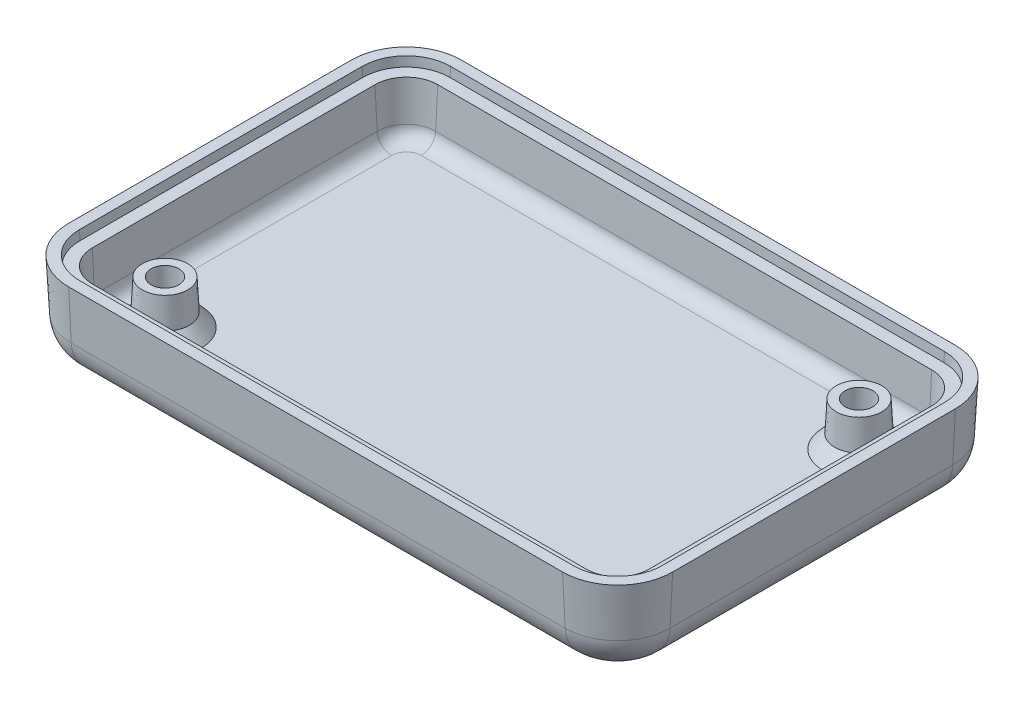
SolidWorks part; units mm, degrees
ref_plane "Front Plane" through (0, 0, 0) normal (0, 0, 1) x (1, 0, 0)
ref_plane "Top Plane" through (0, 0, 0) normal (0, 1, 0) x (1, 0, 0)
ref_plane "Right Plane" through (0, 0, 0) normal (1, 0, 0) x (0, 0, -1)
sketch "Sketch1" plane through (0, 0, 0) normal (0, 1, 0) x (1, 0, 0)
  line L0 (-25.9842, 20.6629) -> (25.9842, 20.6629)
  line L1 (31.7754, -14.8717) -> (31.7754, 14.8717)
  line L2 (-25.9842, -20.6629) -> (25.9842, -20.6629)
  line L3 (-31.7754, -14.8717) -> (-31.7754, 14.8717)
  line L4 (-31.7754, 0) -> (31.7754, 0) construction
  line L5 (0, -20.6629) -> (0, 20.6629) construction
  line L6 (25.9842, 14.8717) -> (-25.9842, -14.8717) construction
  arc A0 (31.7754, 14.8717) -> (25.9842, 20.6629) centre (25.9842, 14.8717) ccw
  arc A1 (25.9842, -20.6629) -> (31.7754, -14.8717) centre (25.9842, -14.8717) ccw
  arc A2 (-31.7754, -14.8717) -> (-25.9842, -20.6629) centre (-25.9842, -14.8717) ccw
  arc A3 (-25.9842, 20.6629) -> (-31.7754, 14.8717) centre (-25.9842, 14.8717) ccw
  dimension "D1" = 5.7912
  dimension "D2" = 63.5508
  dimension "D3" = 41.3258
extrude "Extrude1" add sketch "Sketch1" against normal blind 9.017 draft 3
fillet "Fillet1" radius 3.9624 8 edges at (-29.745, -9.017, 18.6325) (-31.3028, -9.017, 0) (-29.745, -9.017, -18.6325) (0, -9.017, -20.1903) (29.745, -9.017, -18.6325) (31.3028, -9.017, 0) (29.745, -9.017, 18.6325) (0, -9.017, 20.1903)
shell "Shell1" thickness 2.4384
sketch "Sketch2" plane through (0, 0, 0) normal (0, 1, 0) x (-1, 0, 0)
  line L9 (30.6324, -14.8717) -> (30.6324, 14.8717)
  line L10 (25.9842, 19.5199) -> (-25.9842, 19.5199)
  line L11 (-30.6324, 14.8717) -> (-30.6324, -14.8717)
  line L12 (-25.9842, -19.5199) -> (25.9842, -19.5199)
  line L13 (30.6324, -14.8717) -> (30.6324, 14.8717)
  line L14 (25.9842, 19.5199) -> (-25.9842, 19.5199)
  line L15 (-30.6324, 14.8717) -> (-30.6324, -14.8717)
  line L16 (-25.9842, -19.5199) -> (25.9842, -19.5199)
  arc A8 (25.9842, -19.5199) -> (30.6324, -14.8717) centre (25.9842, -14.8717) ccw
  arc A9 (30.6324, 14.8717) -> (25.9842, 19.5199) centre (25.9842, 14.8717) ccw
  arc A10 (-25.9842, 19.5199) -> (-30.6324, 14.8717) centre (-25.9842, 14.8717) ccw
  arc A11 (-30.6324, -14.8717) -> (-25.9842, -19.5199) centre (-25.9842, -14.8717) ccw
  arc A12 (25.9842, -19.5199) -> (30.6324, -14.8717) centre (25.9842, -14.8717) ccw
  arc A13 (30.6324, 14.8717) -> (25.9842, 19.5199) centre (25.9842, 14.8717) ccw
  arc A14 (-25.9842, 19.5199) -> (-30.6324, 14.8717) centre (-25.9842, 14.8717) ccw
  arc A15 (-30.6324, -14.8717) -> (-25.9842, -19.5199) centre (-25.9842, -14.8717) ccw
  dimension "D2" = 39.0398
  dimension "D3" = 61.2648
  dimension "D1" = 1.143
extrude "Cut-Extrude1" cut sketch "Sketch2" against normal blind 0.9906 draft 3
sketch "Sketch3-REF. FOR PLANES" plane through (0, -6.5786, 0) normal (0, 1, 0) x (-1, 0, 0)
  line L0 (0, 0) -> (-50000, 0) construction
  line L1 (0, 0) -> (0, 50000) construction
  line L2 (23.8125, 12.7) -> (0, 0) construction
  line L3 (0, 0) -> (5.8426, -10.9548) construction
  point P1 (23.8125, 12.7)
  point P9 (-23.8125, -12.7)
  dimension "D1" = 28.072
  dimension "D2" = 25.4
  dimension "D3" = 47.625
  dimension "D4" = 47.625
  dimension "D5" = 25.4
ref_plane "Plane1-SCREW TOWER" through (0, 0, 12.7) normal (0, 0, 1) x (1, 0, 0)
sketch "Sketch4" plane through (0, 0, 12.7) normal (0, 0, 1) x (1, 0, 0)
  line L0 (-23.8125, -6.5786) -> (-23.8125, 49993.4214) construction
  line L1 (-23.8125, -1.9812) -> (-21.4249, -1.9812)
  line L2 (-21.4249, -1.9812) -> (-21.2598, -5.1308)
  line L3 (-21.2598, -5.1308) -> (-20.0013, -6.5786)
  line L4 (94117.6471, -6.5786) -> (-94123.4896, -6.5786) construction
  line L5 (-20.0013, -6.5786) -> (-23.8125, -6.5786)
  line L6 (-23.8125, -6.5786) -> (-23.8125, -1.9812)
  dimension "D1" = 4.7752
  dimension "D2" = 4.5974
  dimension "D3" = 93
  dimension "D4" = 49
  dimension "D5" = 1.4478
revolve "Revolve1" add sketch "Sketch4" angle 360 about L0
sketch "10-2023 NEW PINS" plane through (0, 0, 12.7) normal (0, 0, 1) x (1, 0, 0)
  line L7 (-23.8125, -200006.5786) -> (-23.8125, 249993.4214) construction
  line L8 (25.9842, -9.017) -> (-25.9842, -9.017) construction
  line B0 (-18.2894, -47.521) -> (-29.3356, -47.521)
  line B1 (-26.9686, -9.017) -> (-26.9686, -42.7238)
  line B2 (-20.6564, -9.017) -> (-20.6564, -42.7238)
  line B3 (-18.2894, -42.7238) -> (-29.3356, -42.7238)
  line B4 (-29.3356, -42.7238) -> (-29.3356, -47.521)
  line B5 (-18.2894, -42.7238) -> (-18.2894, -47.521)
  line B6 (-26.9686, -9.017) -> (-20.6564, -9.017)
  line B7 (-22.1396, -6.5338) -> (-20.9468, -7.906)
  line B8 (-20.9468, -7.906) -> (-26.6782, -7.906)
  line B9 (-22.155, -6.2397) -> (-22.1396, -6.5338)
  line B10 (-25.47, -6.2397) -> (-25.4854, -6.5338)
  line B11 (-25.4854, -6.5338) -> (-22.1396, -6.5338)
  line B12 (-25.4854, -6.5338) -> (-26.6782, -7.906)
  line B13 (-26.6782, -7.906) -> (-26.7364, -9.017)
  line B14 (-20.9468, -7.906) -> (-20.8886, -9.017)
  line B15 (-23.8125, -47.521) -> (-23.8125, -6.2397)
  line B16 (-22.155, -6.2397) -> (-25.47, -6.2397)
sketch_block_instance "Block3-1"
sketch_block "Block3"
sketch "Sketch5" plane through (0, 0, 12.7) normal (0, 0, 1) x (1, 0, 0)
  line L0 (-23.8125, -6.5786) -> (-23.8125, 1.0752) construction
  line L1 (-23.8125, -1.9812) -> (-22.3481, -1.9812)
  line L2 (-21.4249, -1.9812) -> (-26.2001, -1.9812) construction
  line L3 (-22.3481, -1.9812) -> (-22.3481, -6.2396)
  line L4 (-22.1396, -6.5338) -> (-20.9469, -7.906)
  line L5 (-20.9469, -7.906) -> (-20.8886, -9.017)
  line L6 (-22.1396, -6.5338) -> (-22.1551, -6.2396)
  line L7 (-25.9842, -9.017) -> (25.9842, -9.017) construction
  line L8 (-23.8125, -9.017) -> (-23.8125, -1.9812)
  line L9 (-23.8125, -9.017) -> (-20.8886, -9.017)
  line L10 (-22.1551, -6.2396) -> (-22.3481, -6.2396)
  dimension "D1" = 2.9288
  dimension "D2" = 87
  dimension "D3" = 41
  dimension "D4" = 5.8477
  dimension "D5" = 1.111
  dimension "D6" = 3
  dimension "D7" = 3.3457
  dimension "D8" = 1.6664
revolve "Cut-Revolve1" cut sketch "Sketch5" angle 360 about L0
ref_plane "Plane2" through (0, -6.5786, 0) normal (0.8824, 0, -0.4706) x (-0.4706, 0, -0.8824)
mirror "Mirror1" about plane through (0, -6.5786, 0) normal (0.8824, 0, -0.4706) of "Revolve1", "Cut-Revolve1"
sketch "Sketch6" plane through (0, -9.017, 0) normal (0, -1, 0) x (1, 0, 0)
  line L0 (0, 0) -> (-23.2704, 0) construction
  line L1 (-12.9794, -13.0302) -> (19.431, -13.0302)
  line L2 (-12.9794, -13.0302) -> (-12.9794, 13.0302)
  line L3 (-12.9794, 13.0302) -> (19.431, 13.0302)
  line L4 (19.431, -13.0302) -> (19.431, 13.0302)
  line L5 (0, 0) -> (0, -50000) construction
  dimension "D1" = 32.4104
  dimension "D2" = 19.431
  dimension "D3" = 26.0604
extrude "Cut-Extrude2" cut sketch "Sketch6" against normal blind 0.254
